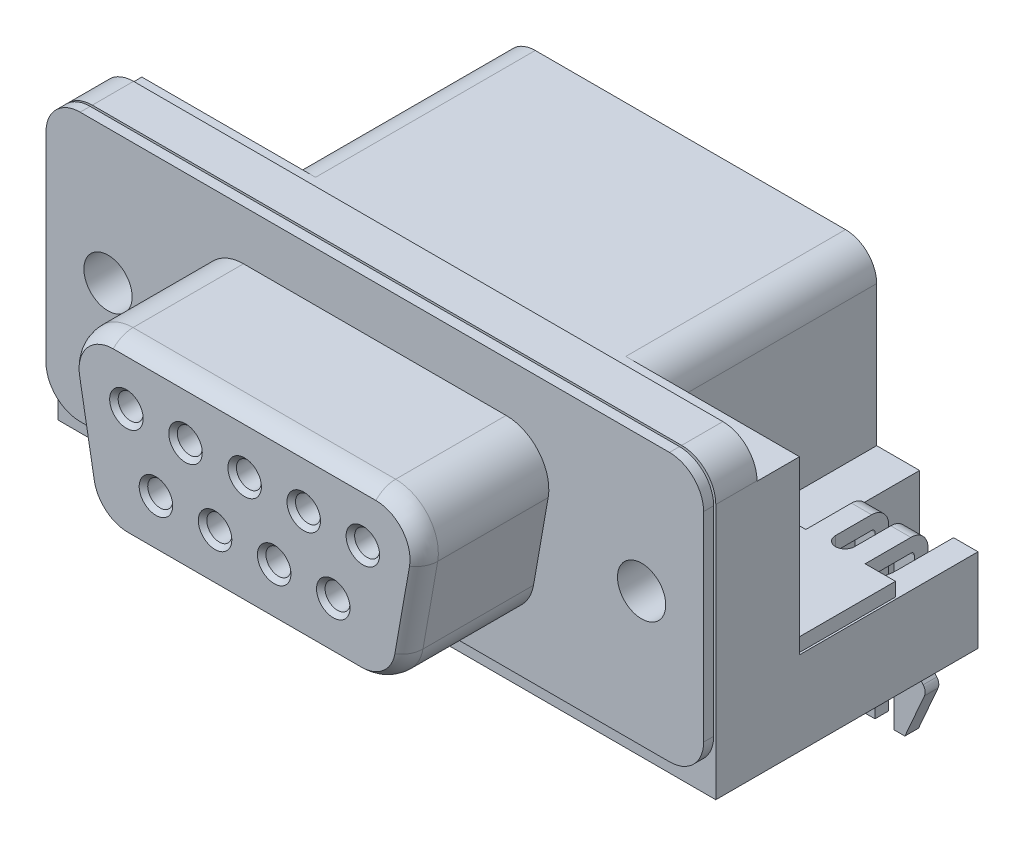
SolidWorks part; units mm, degrees
ref_plane "Front" through (0, 0, 0) normal (0, 0, 1) x (1, 0, 0)
ref_plane "Top" through (0, 0, 0) normal (0, 1, 0) x (1, 0, 0)
ref_plane "Right" through (0, 0, 0) normal (1, 0, 0) x (0, 0, -1)
imported_body "Импортированный1"
sketch "Эскиз1" plane through (0, 0, -6.57) normal (0, 0, 1) x (1, 0, 0)
  line L0 (-14.9, 4.675) -> (-14.9, -4.675)
  line L1 (-13.8, -5.775) -> (13.8, -5.775)
  line L2 (14.9, -4.675) -> (14.9, 4.675)
  line L3 (13.8, 5.775) -> (-13.8, 5.775)
  line L4 (-15.4, 4.675) -> (-15.4, -4.675)
  line L5 (-13.8, -6.275) -> (13.8, -6.275)
  line L6 (15.4, -4.675) -> (15.4, 4.675)
  line L7 (13.8, 6.275) -> (-13.8, 6.275)
  line L8 (-15.4, 4.675) -> (-15.4, -7.3)
  line L9 (-15.4, -7.3) -> (15.4, -7.3)
  line L10 (15.4, -7.3) -> (15.4, 4.675)
  line L11 (13.8, 6.275) -> (-13.8, 6.275)
  line L12 (-13.8, -6.275) -> (13.8, -6.275) construction
  line L13 (-15.4, 4.675) -> (-15.4, -4.675) construction
  line L14 (15.4, -4.675) -> (15.4, 4.675) construction
  arc A0 (-14.9, -4.675) -> (-13.8, -5.775) centre (-13.8, -4.675) ccw
  arc A1 (13.8, -5.775) -> (14.9, -4.675) centre (13.8, -4.675) ccw
  arc A2 (14.9, 4.675) -> (13.8, 5.775) centre (13.8, 4.675) ccw
  arc A3 (-13.8, 5.775) -> (-14.9, 4.675) centre (-13.8, 4.675) ccw
  arc A4 (-13.8, 6.275) -> (-15.4, 4.675) centre (-13.8, 4.675) ccw
  arc A5 (-15.4, -4.675) -> (-13.8, -6.275) centre (-13.8, -4.675) ccw
  arc A6 (13.8, -6.275) -> (15.4, -4.675) centre (13.8, -4.675) ccw
  arc A7 (15.4, 4.675) -> (13.8, 6.275) centre (13.8, 4.675) ccw
  arc A8 (-13.8, 6.275) -> (-15.4, 4.675) centre (-13.8, 4.675) ccw
  arc A11 (15.4, 4.675) -> (13.8, 6.275) centre (13.8, 4.675) ccw
  arc A12 (-15.4, -4.675) -> (-13.8, -6.275) centre (-13.8, -4.675) ccw construction
  arc A13 (13.8, -6.275) -> (15.4, -4.675) centre (13.8, -4.675) ccw construction
  dimension "D1" = 0
  dimension "D2" = 0.5
extrude "Вытянуть1" cut sketch "Эскиз1" against normal blind 0.1
sketch "Эскиз2" plane through (0, -2.74, 0) normal (0, 1, 0) x (1, 0, 0)
  line L0 (-13.885, 15.18) -> (-15.4, 15.18) construction
  line L1 (-15.525, 10.59) -> (-15.3, 10.59)
  line L2 (-15.525, 10.59) -> (-15.525, 15.18)
  line L3 (-15.525, 15.18) -> (-15.3, 15.18)
  line L4 (-15.3, 10.59) -> (-15.3, 15.18)
  line L5 (-9.59, 15.18) -> (-11.105, 15.18) construction
  line L6 (-9.59, 10.59) -> (-9.685, 10.59)
  line L7 (-9.59, 10.59) -> (-9.59, 15.18)
  line L8 (-9.59, 15.18) -> (-9.685, 15.18)
  line L9 (-9.685, 10.59) -> (-9.685, 15.18)
  line L10 (11.105, 15.18) -> (9.465, 15.18) construction
  line L11 (9.465, 10.59) -> (9.685, 10.59)
  line L12 (9.465, 10.59) -> (9.465, 15.18)
  line L13 (9.465, 15.18) -> (9.685, 15.18)
  line L14 (9.685, 10.59) -> (9.685, 15.18)
  line L15 (7.265, 10.59) -> (15.4, 10.59) construction
  line L16 (15.4, 15.18) -> (15.305, 15.18)
  line L17 (15.4, 15.18) -> (15.4, 10.59)
  line L18 (15.4, 10.59) -> (15.305, 10.59)
  line L19 (15.305, 15.18) -> (15.305, 10.59)
  line L20 (-15.4, 15.18) -> (-15.4, 18.95) construction
  line L21 (-13.885, 17.32) -> (-13.885, 15.18) construction
  line L22 (-11.105, 15.18) -> (-11.105, 17.32) construction
  line L23 (11.105, 17.32) -> (11.105, 15.18) construction
  line L24 (13.885, 15.18) -> (13.885, 17.32) construction
  dimension "D1" = 0.1
  dimension "D2" = 1.415
  dimension "D3" = 1.42
  dimension "D4" = 1.42
  dimension "D5" = 1.42
extrude "Вытянуть2" cut sketch "Эскиз2" against normal up to surface (0.64 mm away)
